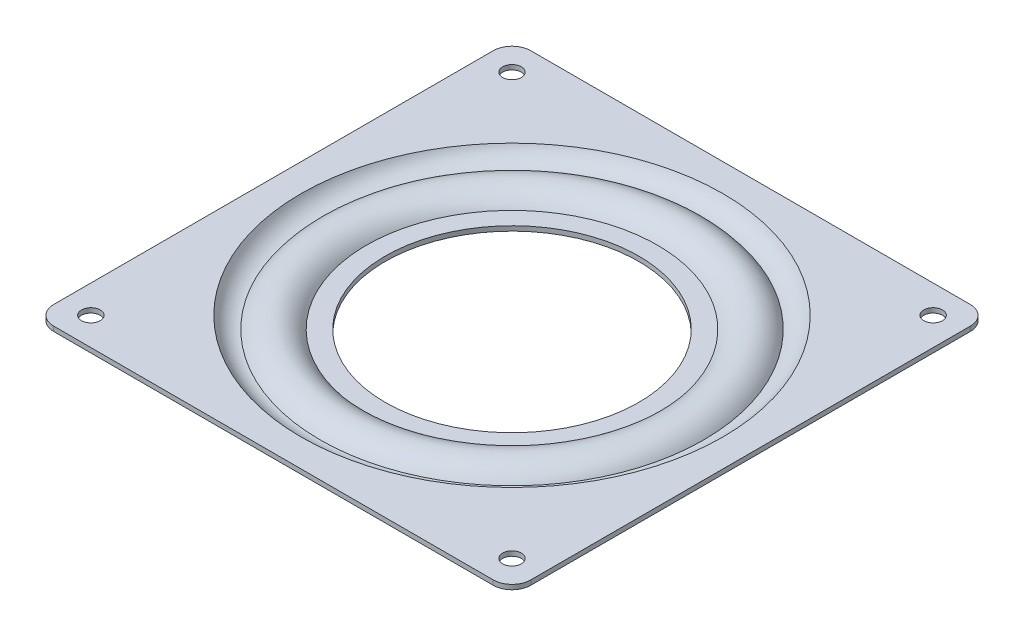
SolidWorks part; units mm, degrees
ref_plane "前视基准面" through (0, 0, 0) normal (0, 0, 1) x (1, 0, 0)
ref_plane "上视基准面" through (0, 0, 0) normal (0, 1, 0) x (1, 0, 0)
ref_plane "右视基准面" through (0, 0, 0) normal (1, 0, 0) x (0, 0, -1)
sketch "草图1" plane through (0, 0, 0) normal (0, 0, 1) x (1, 0, 0)
  line L0 (-36.7805, 0) -> (-35.9228, 0)
  line L1 (0, 6.9172) -> (0, -6.9172) construction
  line L2 (-31, -2.5698) -> (-27, -2.5698)
  line L3 (-35.9228, 0) -> (0, 0) construction
  line L4 (0, 0) -> (43.3864, 0) construction
  line L5 (-43.3864, 0) -> (-36.7805, 0) construction
  line L6 (-31.5531, -3.5698) -> (-27, -3.5698)
  line L7 (-27, -2.5698) -> (-27, -3.5698)
  line L8 (-44.9105, 0) -> (-45.8139, -0.4289)
  arc A0 (-44.9105, 0) -> (-40.8455, -2.5698) centre (-40.8455, 1.9302) ccw
  arc A1 (-40.8455, -2.5698) -> (-31, -2.5698) centre (-35.9228, -6) cw
  arc A2 (-40.8455, -2.5698) -> (-36.8127, -0.0664) centre (-40.8455, 1.9302) ccw construction
  arc A3 (-36.8127, -0.0664) -> (-36.7805, 0) centre (-40.8455, 1.9302) ccw
  arc A4 (-45.8139, -0.4289) -> (-40.2759, -3.5402) centre (-40.8455, 1.9302) ccw
  arc A5 (-40.2759, -3.5402) -> (-31.5531, -3.5698) centre (-35.9228, -6) cw
  point P4 (0, 0)
  point P8 (0, 0)
  dimension "D1" = 4.5
  dimension "D2" = 6
  dimension "D3" = 27
  dimension "D4" = 4
revolve "旋转1" add sketch "草图1" angle 360 about L1
sketch "草图2" plane through (0, 0, 0) normal (0, 1, 0) x (1, 0, 0)
  line L1 (-46.8, 50.8) -> (46.8, 50.8)
  line L2 (-50.8, 46.8) -> (-50.8, -46.8)
  line L3 (-46.8, -50.8) -> (46.8, -50.8)
  line L4 (50.8, 46.8) -> (50.8, -46.8)
  line L5 (-50.8, 50.8) -> (50.8, -50.8) construction
  line L6 (-50.8, -50.8) -> (50.8, 50.8) construction
  circle A0 centre (0, 0) radius 44.9105 construction
  circle A1 centre (0, 0) radius 44.9105
  arc A2 (-46.8, 50.8) -> (-50.8, 46.8) centre (-46.8, 46.8) ccw
  circle A3 centre (-44.845, 44.845) radius 1.985
  circle A4 centre (44.845, 44.845) radius 1.985
  arc A5 (50.8, 46.8) -> (46.8, 50.8) centre (46.8, 46.8) ccw
  circle A6 centre (44.845, -44.845) radius 1.985
  arc A7 (46.8, -50.8) -> (50.8, -46.8) centre (46.8, -46.8) ccw
  circle A8 centre (-44.845, -44.845) radius 1.985
  arc A9 (-50.8, -46.8) -> (-46.8, -50.8) centre (-46.8, -46.8) ccw
  point P14 (0, 0)
  point P32 (0, 0)
  dimension "D3" = 4
  dimension "D4" = 3.97
  dimension "D5" = 4
  dimension "D1" = 90
  dimension "D2" = 101.6
  dimension "D6" = 63.4204
extrude "凸台-拉伸1" add sketch "草图2" against normal blind 1
